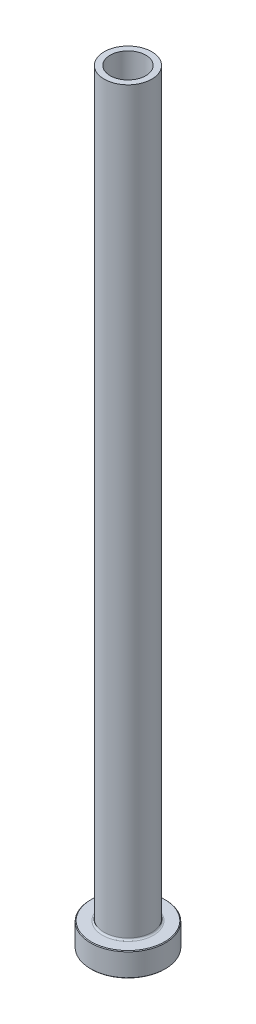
SolidWorks part; units mm, degrees
ref_plane "Front Plane" through (0, 0, 0) normal (0, 0, 1) x (1, 0, 0)
ref_plane "Top Plane" through (0, 0, 0) normal (0, 1, 0) x (1, 0, 0)
ref_plane "Right Plane" through (0, 0, 0) normal (1, 0, 0) x (0, 0, -1)
sketch "Sketch1" plane through (0, 0, 0) normal (0, 0, 1) x (1, 0, 0)
  line L0 (-5.25, 225) -> (-7, 225)
  line L1 (-7, 225) -> (-7, 7)
  line L2 (-7, 7) -> (-11, 7)
  line L3 (-11, 7) -> (-11, 0)
  line L4 (12.1, 0) -> (-12.1, 0) construction
  line L5 (-11, 0) -> (-5.5, 0)
  line L6 (-5.25, 170) -> (-5.25, 225)
  line L7 (0, 92.1877) -> (0, -15.5353) construction
  line L8 (0, -12.1) -> (0, 12.1) construction
  line L9 (-5.25, 170) -> (-5.5, 158)
  line L10 (-5.5, 158) -> (-5.5, 0)
  dimension "D1" = 0.25
  dimension "ID" = 10.5
  dimension "OD" = 14
  dimension "L" = 225
  dimension "H" = 22
  dimension "T" = 7
  dimension "N" = 55
  dimension "D2" = 12
revolve "Revolve1" add sketch "Sketch1" angle 360 about L7
fillet "Fillet1" radius 0.5 1 edges at (0, 7, 7)
chamfer "Chamfer1" distance 0.2 angle 45 2 edges at (0, 7, 11) (0, 0, 11)
chamfer "Chamfer3" distance 0.5 angle 45 1 edges at (0, 0, 5.5)
